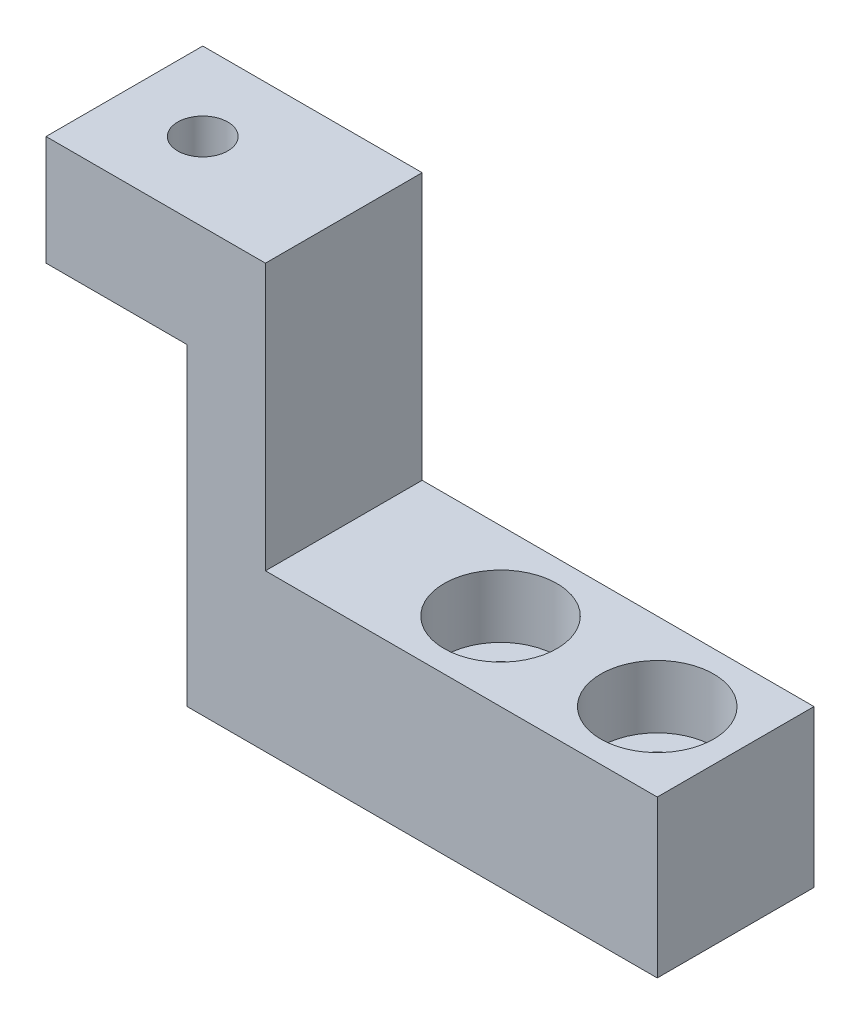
SolidWorks part; units mm, degrees
ref_plane "Plan1" through (0, 0, 0) normal (0, 0, 1) x (1, 0, 0)
ref_plane "Plan2" through (0, 0, 0) normal (0, 1, 0) x (1, 0, 0)
ref_plane "Plan3" through (0, 0, 0) normal (1, 0, 0) x (0, 0, -1)
sketch "Esquisse1" plane through (0, 0, 0) normal (0, 0, 1) x (1, 0, 0)
  line L0 (0, 0) -> (-30, 0)
  line L1 (-30, 0) -> (-30, 20)
  line L2 (-30, 20) -> (-39, 20)
  line L3 (-39, 20) -> (-39, 27)
  line L4 (-39, 27) -> (-25, 27)
  line L5 (-25, 27) -> (-25, 10)
  line L6 (-25, 10) -> (0, 10)
  line L7 (0, 10) -> (0, 0)
  dimension "D1" = 39
  dimension "D2" = 30
  dimension "D3" = 14
  dimension "D4" = 10
  dimension "D5" = 27
  dimension "D6" = 20
extrude "Base-Extrusion" add sketch "Esquisse1" along normal blind 10
other "Perçage1"
sketch "Esquisse2" plane through (0, 10, 0) normal (0, 1, 0) x (-1, 0, 0)
  line L0 (0, 10) -> (0, 0) construction
  line L1 (25, 10) -> (0, 10) construction
  circle A0 centre (5, 5) radius 2.1
  dimension "D1" = 4.2
  dimension "D2" = 5
  dimension "D3" = 5
other "Perçage2" parameters "D1"=10
sketch "Esquisse3" plane through (0, 10, 0) normal (0, 1, 0) x (-1, 0, 0)
  line L0 (0, 10) -> (0, 0) construction
  circle A0 centre (15, 5) radius 2.1
  dimension "D1" = 4.2
  dimension "D2" = 15
other "Perçage3" parameters "D1"=4
sketch "Esquisse4" plane through (0, 10, 0) normal (0, 1, 0) x (-1, 0, 0)
  circle A0 centre (15, 5) radius 3.6
  circle A1 centre (15, 5) radius 2.1 construction
  dimension "D1" = 7.2
other "Perçage4" parameters "D1"=4
sketch "Esquisse5" plane through (0, 10, 0) normal (0, 1, 0) x (-1, 0, 0)
  circle A0 centre (5, 5) radius 3.6
  circle A1 centre (5, 5) radius 2.1 construction
  dimension "D1" = 7.2
other "Perçage5"
sketch "Esquisse6" plane through (0, 27, 0) normal (0, 1, 0) x (-1, 0, 0)
  line L0 (0, 10) -> (0, 0) construction
  line L1 (39, 0) -> (25, 0) construction
  circle A0 centre (34, 5) radius 1.6
  circle A1 centre (15, 5) radius 2.1 construction
  dimension "D1" = 3.2
  dimension "D2" = 34
  dimension "D3" = 5
